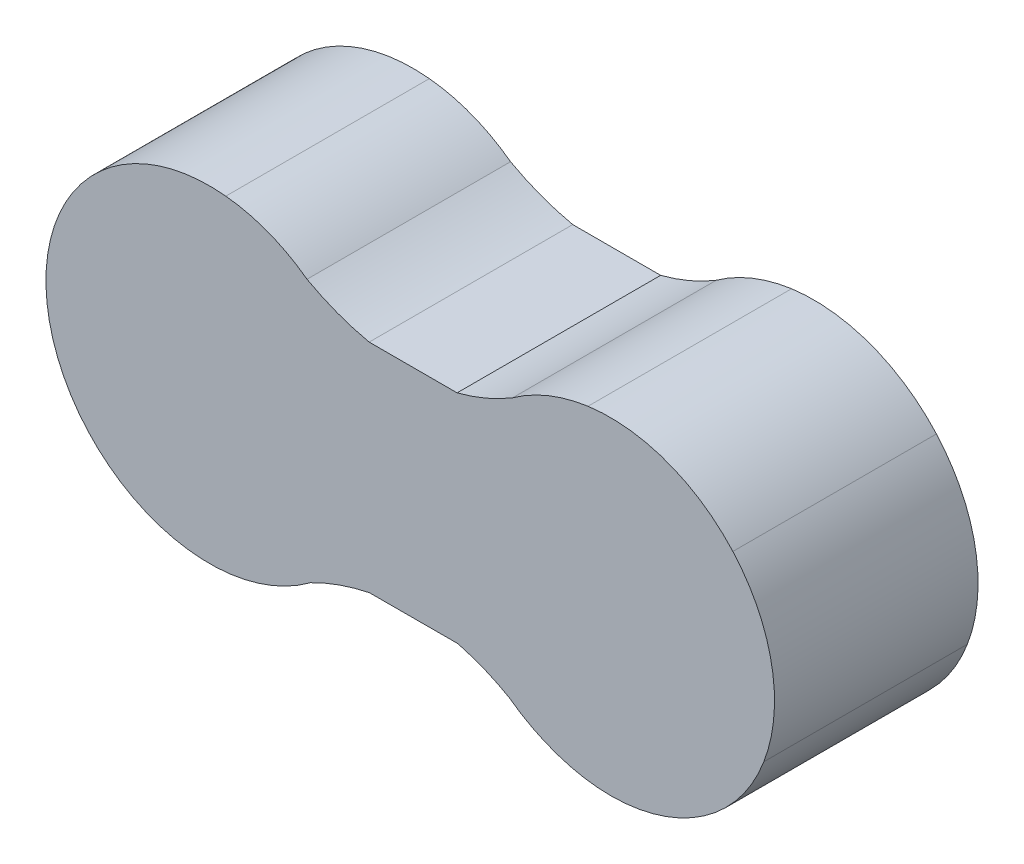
SolidWorks part; units mm, degrees
ref_plane "Front Plane" through (0, 0, 0) normal (0, 0, 1) x (1, 0, 0)
ref_plane "Top Plane" through (0, 0, 0) normal (0, 1, 0) x (1, 0, 0)
ref_plane "Right Plane" through (0, 0, 0) normal (1, 0, 0) x (0, 0, -1)
sketch "GENERAL" plane through (0, 0, 0) normal (0, 0, 1) x (1, 0, 0)
  line L0 (0.1181, 0.2672) -> (-0.1017, 0.2672)
  line L1 (-0.1017, 0.2672) -> (-0.1075, 0.2695)
  line L2 (-0.1075, 0.2695) -> (-0.1181, 0.2718)
  line L3 (-0.1181, 0.2718) -> (-0.1276, 0.2739)
  line L4 (-0.1276, 0.2739) -> (-0.1443, 0.2781)
  line L5 (-0.1443, 0.2781) -> (-0.1526, 0.2804)
  line L6 (-0.1526, 0.2804) -> (-0.1636, 0.2839)
  line L7 (-0.1636, 0.2839) -> (-0.1733, 0.2869)
  line L8 (-0.1733, 0.2869) -> (-0.1821, 0.2901)
  line L9 (-0.1821, 0.2901) -> (-0.1968, 0.2957)
  line L10 (-0.1968, 0.2957) -> (-0.212, 0.3018)
  line L11 (-0.212, 0.3018) -> (-0.2186, 0.3049)
  line L12 (-0.2186, 0.3049) -> (-0.2239, 0.3073)
  line L13 (-0.2239, 0.3073) -> (-0.2327, 0.3115)
  line L14 (-0.2327, 0.3115) -> (-0.2357, 0.3131)
  line L15 (-0.2357, 0.3131) -> (-0.2374, 0.3139)
  line L16 (-0.2374, 0.3139) -> (-0.2395, 0.315)
  line L17 (-0.2395, 0.315) -> (-0.2426, 0.3166)
  line L18 (-0.2426, 0.3166) -> (-0.2444, 0.3176)
  line L19 (-0.2444, 0.3176) -> (-0.2473, 0.3191)
  line L20 (-0.2473, 0.3191) -> (-0.2495, 0.3203)
  line L21 (-0.2495, 0.3203) -> (-0.2516, 0.3215)
  line L22 (-0.2516, 0.3215) -> (-0.2528, 0.3221)
  line L23 (-0.2528, 0.3221) -> (-0.2533, 0.3224)
  line L24 (-0.2533, 0.3224) -> (-0.2577, 0.3258)
  line L25 (-0.2577, 0.3258) -> (-0.2643, 0.3305)
  line L26 (-0.2643, 0.3305) -> (-0.273, 0.3365)
  line L27 (-0.273, 0.3365) -> (-0.2804, 0.3415)
  line L28 (-0.2804, 0.3415) -> (-0.2892, 0.3469)
  line L29 (-0.2892, 0.3469) -> (-0.2981, 0.3522)
  line L30 (-0.2981, 0.3522) -> (-0.306, 0.3566)
  line L31 (-0.306, 0.3566) -> (-0.3155, 0.3616)
  line L32 (-0.3155, 0.3616) -> (-0.3251, 0.3663)
  line L33 (-0.3251, 0.3663) -> (-0.332, 0.3694)
  line L34 (-0.332, 0.3694) -> (-0.3414, 0.3736)
  line L35 (-0.3414, 0.3736) -> (-0.3434, 0.3744)
  line L36 (-0.3434, 0.3744) -> (-0.3546, 0.3789)
  line L37 (-0.3546, 0.3789) -> (-0.3622, 0.3817)
  line L38 (-0.3622, 0.3817) -> (-0.3649, 0.3827)
  line L39 (-0.3649, 0.3827) -> (-0.3792, 0.3875)
  line L40 (-0.3792, 0.3875) -> (-0.3899, 0.3906)
  line L41 (-0.3899, 0.3906) -> (-0.4141, 0.3967)
  line L42 (-0.4141, 0.3967) -> (-0.4335, 0.4005)
  line L43 (-0.4335, 0.4005) -> (-0.4522, 0.403)
  line L44 (-0.4522, 0.403) -> (-0.4669, 0.4044)
  line L45 (-0.4669, 0.4044) -> (-0.4823, 0.4055)
  line L46 (-0.4823, 0.4055) -> (-0.4976, 0.4059)
  line L47 (-0.4976, 0.4059) -> (-0.5109, 0.4057)
  line L48 (-0.5109, 0.4057) -> (-0.5225, 0.4051)
  line L49 (-0.5225, 0.4051) -> (-0.5303, 0.4047)
  line L50 (-0.5303, 0.4047) -> (-0.54, 0.4038)
  line L51 (-0.54, 0.4038) -> (-0.551, 0.4026)
  line L52 (-0.551, 0.4026) -> (-0.5785, 0.3984)
  line L53 (-0.5785, 0.3984) -> (-0.6231, 0.3869)
  line L54 (-0.6231, 0.3869) -> (-0.6508, 0.377)
  line L55 (-0.6508, 0.377) -> (-0.6819, 0.3635)
  line L56 (-0.6819, 0.3635) -> (-0.7168, 0.3433)
  line L57 (-0.7168, 0.3433) -> (-0.7576, 0.314)
  line L58 (-0.7576, 0.314) -> (-0.7821, 0.2915)
  line L59 (-0.7821, 0.2915) -> (-0.8028, 0.2712)
  line L60 (-0.8028, 0.2712) -> (-0.8242, 0.2447)
  line L61 (-0.8242, 0.2447) -> (-0.8394, 0.2233)
  line L62 (-0.8394, 0.2233) -> (-0.8614, 0.1859)
  line L63 (-0.8614, 0.1859) -> (-0.8724, 0.1623)
  line L64 (-0.8724, 0.1623) -> (-0.8811, 0.1402)
  line L65 (-0.8811, 0.1402) -> (-0.8849, 0.1303)
  line L66 (-0.8849, 0.1303) -> (-0.8921, 0.1077)
  line L67 (-0.8921, 0.1077) -> (-0.9001, 0.0717)
  line L68 (-0.9001, 0.0717) -> (-0.9045, 0.0409)
  line L69 (-0.9045, 0.0409) -> (-0.9064, 0.0062)
  line L70 (-0.9064, 0.0062) -> (-0.9064, -0.0114)
  line L71 (-0.9064, -0.0114) -> (-0.9042, -0.0468)
  line L72 (-0.9042, -0.0468) -> (-0.9009, -0.0683)
  line L73 (-0.9009, -0.0683) -> (-0.8943, -0.1005)
  line L74 (-0.8943, -0.1005) -> (-0.8877, -0.1227)
  line L75 (-0.8877, -0.1227) -> (-0.8805, -0.1445)
  line L76 (-0.8805, -0.1445) -> (-0.8682, -0.1728)
  line L77 (-0.8682, -0.1728) -> (-0.8506, -0.2066)
  line L78 (-0.8506, -0.2066) -> (-0.831, -0.2363)
  line L79 (-0.831, -0.2363) -> (-0.8178, -0.2545)
  line L80 (-0.8178, -0.2545) -> (-0.8044, -0.2702)
  line L81 (-0.8044, -0.2702) -> (-0.7942, -0.281)
  line L82 (-0.7942, -0.281) -> (-0.7737, -0.3011)
  line L83 (-0.7737, -0.3011) -> (-0.7545, -0.3177)
  line L84 (-0.7545, -0.3177) -> (-0.7374, -0.3308)
  line L85 (-0.7374, -0.3308) -> (-0.7239, -0.34)
  line L86 (-0.7239, -0.34) -> (-0.7137, -0.3464)
  line L87 (-0.7137, -0.3464) -> (-0.6962, -0.3566)
  line L88 (-0.6962, -0.3566) -> (-0.6705, -0.3697)
  line L89 (-0.6705, -0.3697) -> (-0.65, -0.3781)
  line L90 (-0.65, -0.3781) -> (-0.6283, -0.3864)
  line L91 (-0.6283, -0.3864) -> (-0.5995, -0.3947)
  line L92 (-0.5995, -0.3947) -> (-0.5757, -0.4001)
  line L93 (-0.5757, -0.4001) -> (-0.5478, -0.4042)
  line L94 (-0.5478, -0.4042) -> (-0.5235, -0.4065)
  line L95 (-0.5235, -0.4065) -> (-0.502, -0.4071)
  line L96 (-0.502, -0.4071) -> (-0.4639, -0.4057)
  line L97 (-0.4639, -0.4057) -> (-0.4478, -0.4036)
  line L98 (-0.4478, -0.4036) -> (-0.4134, -0.398)
  line L99 (-0.4134, -0.398) -> (-0.3919, -0.3926)
  line L100 (-0.3919, -0.3926) -> (-0.3635, -0.3835)
  line L101 (-0.3635, -0.3835) -> (-0.341, -0.375)
  line L102 (-0.341, -0.375) -> (-0.3232, -0.367)
  line L103 (-0.3232, -0.367) -> (-0.2985, -0.3537)
  line L104 (-0.2985, -0.3537) -> (-0.2604, -0.3295)
  line L105 (-0.2604, -0.3295) -> (-0.2491, -0.3224)
  line L106 (-0.2491, -0.3224) -> (-0.2342, -0.3151)
  line L107 (-0.2342, -0.3151) -> (-0.2079, -0.3028)
  line L108 (-0.2079, -0.3028) -> (-0.1868, -0.2945)
  line L109 (-0.1868, -0.2945) -> (-0.1741, -0.2899)
  line L110 (-0.1741, -0.2899) -> (-0.1451, -0.281)
  line L111 (-0.1451, -0.281) -> (-0.1265, -0.2764)
  line L112 (-0.1265, -0.2764) -> (-0.1102, -0.2726)
  line L113 (-0.1102, -0.2726) -> (-0.1013, -0.2702)
  line L114 (-0.1013, -0.2702) -> (-0.0886, -0.2702)
  line L115 (-0.0886, -0.2702) -> (0.1186, -0.2699)
  line L116 (0.1186, -0.2699) -> (0.1268, -0.2719)
  line L117 (0.1268, -0.2719) -> (0.1438, -0.2769)
  line L118 (0.1438, -0.2769) -> (0.1632, -0.2833)
  line L119 (0.1632, -0.2833) -> (0.18, -0.2895)
  line L120 (0.18, -0.2895) -> (0.2059, -0.3002)
  line L121 (0.2059, -0.3002) -> (0.2223, -0.3083)
  line L122 (0.2223, -0.3083) -> (0.2382, -0.3165)
  line L123 (0.2382, -0.3165) -> (0.2608, -0.3299)
  line L124 (0.2608, -0.3299) -> (0.2739, -0.3382)
  line L125 (0.2739, -0.3382) -> (0.2765, -0.3401)
  line L126 (0.2765, -0.3401) -> (0.2933, -0.3504)
  line L127 (0.2933, -0.3504) -> (0.3076, -0.3587)
  line L128 (0.3076, -0.3587) -> (0.3201, -0.3653)
  line L129 (0.3201, -0.3653) -> (0.3414, -0.375)
  line L130 (0.3414, -0.375) -> (0.3593, -0.3823)
  line L131 (0.3593, -0.3823) -> (0.3827, -0.3901)
  line L132 (0.3827, -0.3901) -> (0.3997, -0.3949)
  line L133 (0.3997, -0.3949) -> (0.4221, -0.4001)
  line L134 (0.4221, -0.4001) -> (0.4429, -0.4037)
  line L135 (0.4429, -0.4037) -> (0.4627, -0.4059)
  line L136 (0.4627, -0.4059) -> (0.4817, -0.4072)
  line L137 (0.4817, -0.4072) -> (0.5052, -0.4078)
  line L138 (0.5052, -0.4078) -> (0.5276, -0.4069)
  line L139 (0.5276, -0.4069) -> (0.5542, -0.4043)
  line L140 (0.5542, -0.4043) -> (0.5738, -0.4013)
  line L141 (0.5738, -0.4013) -> (0.5937, -0.3971)
  line L142 (0.5937, -0.3971) -> (0.6127, -0.3922)
  line L143 (0.6127, -0.3922) -> (0.6358, -0.3851)
  line L144 (0.6358, -0.3851) -> (0.6623, -0.3746)
  line L145 (0.6623, -0.3746) -> (0.682, -0.3652)
  line L146 (0.682, -0.3652) -> (0.7064, -0.3523)
  line L147 (0.7064, -0.3523) -> (0.7319, -0.3358)
  line L148 (0.7319, -0.3358) -> (0.7543, -0.3196)
  line L149 (0.7543, -0.3196) -> (0.7677, -0.3082)
  line L150 (0.7677, -0.3082) -> (0.7855, -0.2918)
  line L151 (0.7855, -0.2918) -> (0.7992, -0.2778)
  line L152 (0.7992, -0.2778) -> (0.8201, -0.2533)
  line L153 (0.8201, -0.2533) -> (0.8304, -0.2395)
  line L154 (0.8304, -0.2395) -> (0.8404, -0.2251)
  line L155 (0.8404, -0.2251) -> (0.8553, -0.202)
  line L156 (0.8553, -0.202) -> (0.8738, -0.1644)
  line L157 (0.8738, -0.1644) -> (0.8889, -0.1253)
  line L158 (0.8889, -0.1253) -> (0.8978, -0.0938)
  line L159 (0.8978, -0.0938) -> (0.9028, -0.0657)
  line L160 (0.9028, -0.0657) -> (0.9055, -0.0468)
  line L161 (0.9055, -0.0468) -> (0.9076, -0.0264)
  line L162 (0.9076, -0.0264) -> (0.9083, -0.0008)
  line L163 (0.9083, -0.0008) -> (0.9072, 0.0253)
  line L164 (0.9072, 0.0253) -> (0.9015, 0.0709)
  line L165 (0.9015, 0.0709) -> (0.8961, 0.0957)
  line L166 (0.8961, 0.0957) -> (0.894, 0.103)
  line L167 (0.894, 0.103) -> (0.8789, 0.1499)
  line L168 (0.8789, 0.1499) -> (0.8607, 0.1898)
  line L169 (0.8607, 0.1898) -> (0.8487, 0.2098)
  line L170 (0.8487, 0.2098) -> (0.8351, 0.2312)
  line L171 (0.8351, 0.2312) -> (0.8177, 0.2542)
  line L172 (0.8177, 0.2542) -> (0.8046, 0.2692)
  line L173 (0.8046, 0.2692) -> (0.7927, 0.2816)
  line L174 (0.7927, 0.2816) -> (0.7826, 0.2919)
  line L175 (0.7826, 0.2919) -> (0.7685, 0.3051)
  line L176 (0.7685, 0.3051) -> (0.7603, 0.3118)
  line L177 (0.7603, 0.3118) -> (0.7538, 0.3173)
  line L178 (0.7538, 0.3173) -> (0.7412, 0.3268)
  line L179 (0.7412, 0.3268) -> (0.7281, 0.336)
  line L180 (0.7281, 0.336) -> (0.7165, 0.3435)
  line L181 (0.7165, 0.3435) -> (0.707, 0.3492)
  line L182 (0.707, 0.3492) -> (0.6953, 0.3559)
  line L183 (0.6953, 0.3559) -> (0.6788, 0.3642)
  line L184 (0.6788, 0.3642) -> (0.6648, 0.3708)
  line L185 (0.6648, 0.3708) -> (0.656, 0.3744)
  line L186 (0.656, 0.3744) -> (0.64, 0.3808)
  line L187 (0.64, 0.3808) -> (0.6043, 0.3924)
  line L188 (0.6043, 0.3924) -> (0.567, 0.4001)
  line L189 (0.567, 0.4001) -> (0.5348, 0.4039)
  line L190 (0.5348, 0.4039) -> (0.5064, 0.4053)
  line L191 (0.5064, 0.4053) -> (0.4831, 0.4049)
  line L192 (0.4831, 0.4049) -> (0.4449, 0.4016)
  line L193 (0.4449, 0.4016) -> (0.4109, 0.3955)
  line L194 (0.4109, 0.3955) -> (0.3797, 0.387)
  line L195 (0.3797, 0.387) -> (0.3424, 0.3732)
  line L196 (0.3424, 0.3732) -> (0.3182, 0.362)
  line L197 (0.3182, 0.362) -> (0.2898, 0.3461)
  line L198 (0.2898, 0.3461) -> (0.2576, 0.3262)
  line L199 (0.2576, 0.3262) -> (0.2273, 0.3088)
  line L200 (0.2273, 0.3088) -> (0.217, 0.3036)
  line L201 (0.217, 0.3036) -> (0.2044, 0.2977)
  line L202 (0.2044, 0.2977) -> (0.185, 0.2895)
  line L203 (0.185, 0.2895) -> (0.1669, 0.2827)
  line L204 (0.1669, 0.2827) -> (0.1438, 0.2748)
  line L205 (0.1438, 0.2748) -> (0.123, 0.2689)
  line L206 (0.123, 0.2689) -> (0.1189, 0.2676)
  line L207 (0.1189, 0.2676) -> (0.1181, 0.2672)
extrude "Boss-Extrude1" add sketch "GENERAL" along normal blind 0.508
sketch "Sketch1" plane through (0, 0, 0.508) normal (0, 0, 1) x (1, 0, 0)
  line L0 (0.656, 0.3744) -> (0.64, 0.3808) construction
  line L1 (0.8738, -0.1644) -> (0.8889, -0.1253) construction
  line L2 (0.4221, -0.4001) -> (0.4429, -0.4037) construction
  line L3 (0.2382, -0.3165) -> (0.2608, -0.3299) construction
  line L4 (-0.3919, -0.3926) -> (-0.3635, -0.3835) construction
  line L5 (-0.831, -0.2363) -> (-0.8178, -0.2545) construction
  line L6 (-0.9045, 0.0409) -> (-0.9064, 0.0062) construction
  line L9 (-0.7576, 0.314) -> (-0.7821, 0.2915) construction
  line L10 (-0.4522, 0.403) -> (-0.4669, 0.4044) construction
  line L11 (-0.1017, 0.2672) -> (-0.0977, 0.2672)
  line L12 (0.1181, 0.2672) -> (-0.1017, 0.2672) construction
  line L13 (-0.0977, 0.2672) -> (0.1181, 0.2672)
  line L14 (-0.1013, -0.2702) -> (0.1186, -0.2699)
  line L15 (0.1268, -0.2719) -> (0.1186, -0.2699)
  line L16 (-0.1741, -0.2899) -> (-0.1451, -0.281) construction
  line L17 (0.3593, -0.3823) -> (0.3827, -0.3901) construction
  line L18 (0.2044, 0.2977) -> (0.185, 0.2895) construction
  line L19 (-0.1443, 0.2781) -> (-0.1526, 0.2804) construction
  line L20 (-0.1015, 0.2692) -> (-0.0977, 0.2692)
  line L21 (-0.0977, 0.2692) -> (0.1179, 0.2692)
  line L22 (0.1263, -0.2738) -> (0.1184, -0.2719)
  line L23 (-0.1011, -0.2722) -> (0.1184, -0.2719)
  line L24 (-0.1019, 0.2652) -> (-0.0977, 0.2652)
  line L25 (-0.0977, 0.2652) -> (0.1184, 0.2652)
  line L26 (0.1273, -0.27) -> (0.1188, -0.2679)
  line L27 (-0.1015, -0.2682) -> (0.1188, -0.2679)
  arc A0 (0.1181, 0.2672) -> (0.2576, 0.3262) centre (-0.0127, 0.7708) ccw
  arc A1 (0.2576, 0.3262) -> (0.4449, 0.4016) centre (0.5051, -0.0179) cw
  arc A2 (0.4449, 0.4016) -> (0.8046, 0.2692) centre (0.4999, -0.0039) cw
  arc A3 (0.8046, 0.2692) -> (0.8814, -0.1448) centre (0.5045, -0.0006) cw
  arc A4 (0.8814, -0.1448) -> (0.4325, -0.4019) centre (0.5016, -0.002) cw
  arc A5 (0.4325, -0.4019) -> (0.2495, -0.3232) centre (0.5101, 0.0305) cw
  arc A6 (0.2495, -0.3232) -> (0.1268, -0.2719) centre (-0.0052, -0.7601) ccw
  arc A7 (-0.1013, -0.2702) -> (-0.2491, -0.3224) centre (0.0161, -0.8382) ccw
  arc A8 (-0.2491, -0.3224) -> (-0.3777, -0.3881) centre (-0.5076, 0.0251) cw
  arc A9 (-0.3777, -0.3881) -> (-0.8244, -0.2454) centre (-0.4998, 0.0002) cw
  arc A10 (-0.8244, -0.2454) -> (-0.9054, 0.0236) centre (-0.5024, -0.0017) cw
  arc A11 (-0.9054, 0.0236) -> (-0.7699, 0.3028) centre (-0.4974, -0.002) cw
  arc A12 (-0.7699, 0.3028) -> (-0.4596, 0.4037) centre (-0.5002, 0.0011) cw
  arc A13 (-0.4596, 0.4037) -> (-0.2577, 0.3258) centre (-0.4994, 0.0003) cw
  arc A14 (-0.2577, 0.3258) -> (-0.1017, 0.2672) centre (0.0182, 0.8241) ccw
  arc A15 (0.1179, 0.2692) -> (0.2564, 0.3278) centre (-0.0127, 0.7708) ccw
  arc A16 (0.2564, 0.3278) -> (0.4446, 0.4036) centre (0.5051, -0.0179) cw
  arc A17 (0.4446, 0.4036) -> (0.8061, 0.2705) centre (0.4999, -0.0039) cw
  arc A18 (0.8061, 0.2705) -> (0.8833, -0.1455) centre (0.5045, -0.0006) cw
  arc A19 (0.8833, -0.1455) -> (0.4321, -0.4039) centre (0.5016, -0.002) cw
  arc A20 (0.4321, -0.4039) -> (0.2484, -0.3249) centre (0.5101, 0.0305) cw
  arc A21 (0.2484, -0.3249) -> (0.1263, -0.2738) centre (-0.0052, -0.7601) ccw
  arc A22 (-0.1011, -0.2722) -> (-0.248, -0.3241) centre (0.0161, -0.8382) ccw
  arc A23 (-0.248, -0.3241) -> (-0.3771, -0.39) centre (-0.5076, 0.0251) cw
  arc A24 (-0.3771, -0.39) -> (-0.826, -0.2466) centre (-0.4998, 0.0002) cw
  arc A25 (-0.826, -0.2466) -> (-0.9074, 0.0237) centre (-0.5024, -0.0017) cw
  arc A26 (-0.9074, 0.0237) -> (-0.7712, 0.3043) centre (-0.4974, -0.002) cw
  arc A27 (-0.7712, 0.3043) -> (-0.4594, 0.4057) centre (-0.5002, 0.0011) cw
  arc A28 (-0.4594, 0.4057) -> (-0.2567, 0.3274) centre (-0.4994, 0.0003) cw
  arc A29 (-0.2567, 0.3274) -> (-0.1015, 0.2692) centre (0.0182, 0.8241) ccw
  arc A30 (0.1184, 0.2652) -> (0.2587, 0.3245) centre (-0.0127, 0.7708) ccw
  arc A31 (0.2587, 0.3245) -> (0.4452, 0.3997) centre (0.5051, -0.0179) cw
  arc A32 (0.4452, 0.3997) -> (0.8031, 0.2679) centre (0.4999, -0.0039) cw
  arc A33 (0.8031, 0.2679) -> (0.8795, -0.1441) centre (0.5045, -0.0006) cw
  arc A34 (0.8795, -0.1441) -> (0.4328, -0.3999) centre (0.5016, -0.002) cw
  arc A35 (0.4328, -0.3999) -> (0.2506, -0.3215) centre (0.5101, 0.0305) cw
  arc A36 (0.2506, -0.3215) -> (0.1273, -0.27) centre (-0.0052, -0.7601) ccw
  arc A37 (-0.1015, -0.2682) -> (-0.2501, -0.3207) centre (0.0161, -0.8382) ccw
  arc A38 (-0.2501, -0.3207) -> (-0.3783, -0.3862) centre (-0.5076, 0.0251) cw
  arc A39 (-0.3783, -0.3862) -> (-0.8228, -0.2442) centre (-0.4998, 0.0002) cw
  arc A40 (-0.8228, -0.2442) -> (-0.9034, 0.0234) centre (-0.5024, -0.0017) cw
  arc A41 (-0.9034, 0.0234) -> (-0.7686, 0.3013) centre (-0.4974, -0.002) cw
  arc A42 (-0.7686, 0.3013) -> (-0.4598, 0.4017) centre (-0.5002, 0.0011) cw
  arc A43 (-0.4598, 0.4017) -> (-0.2588, 0.3241) centre (-0.4994, 0.0003) cw
  arc A44 (-0.2588, 0.3241) -> (-0.1019, 0.2652) centre (0.0182, 0.8241) ccw
  dimension "D1" = 0.002
  dimension "D2" = 0.002
extrude "Boss-Extrude7" add sketch "Sketch1" against normal up to surface (0.508 mm away) contours A29 A28 A27 A26 A25 A24 A23 A22 L23 L22 A21 A20 A19 A18 A17 A16 A15 L21 L20 A13 A14 L11 L13 A0 A1 A2 A3 A4 A5 A6 L15 L14 A7 A8 A9 A10 A11 A12 | A14 A13 A12 A11 A10 A9 A8 A7 L14 L15 A6 A5 A4 A3 A2 A1 A0 L13 L11 A43 A44 L24 L25 A30 A31 A32 A33 A34 A35 A36 L26 L27 A37 A38 A39 A40 A41 A42
